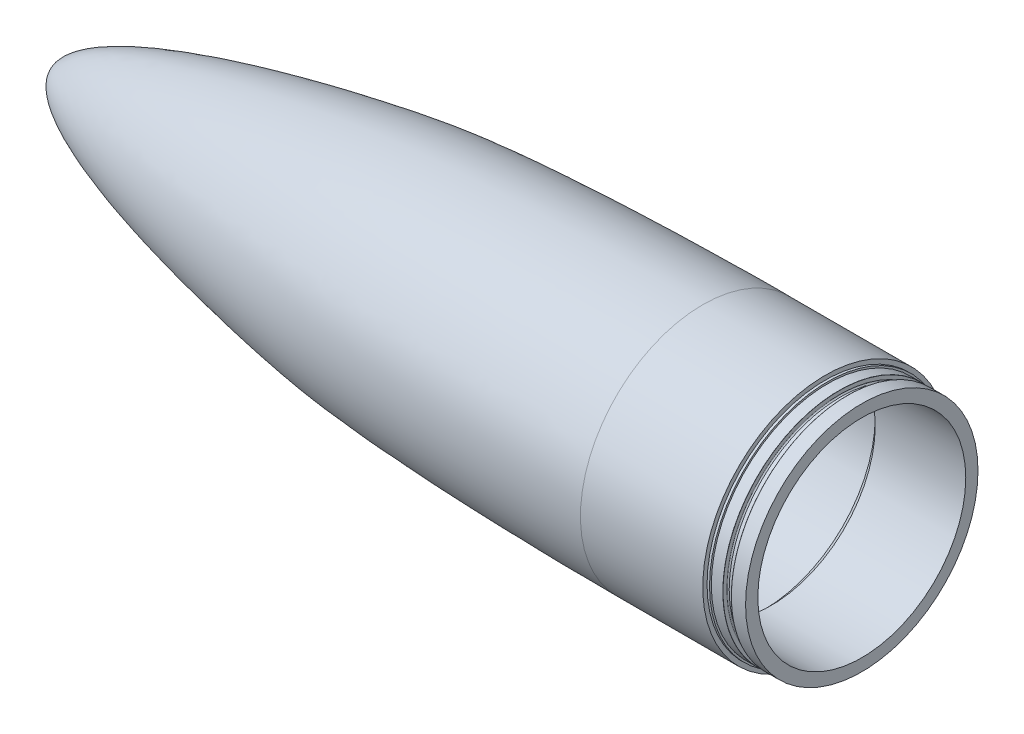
SolidWorks part; units mm, degrees
ref_plane "Plan de face" through (0, 0, 0) normal (0, 0, 1) x (1, 0, 0)
ref_plane "Plan de dessus" through (0, 0, 0) normal (0, 1, 0) x (1, 0, 0)
ref_plane "Plan de droite" through (0, 0, 0) normal (1, 0, 0) x (0, 0, -1)
sketch "Esquisse1" plane through (0, 0, 0) normal (0, 0, 1) x (1, 0, 0)
  line L0 (20.145, 0) -> (-649.6872, 0) construction
  line L1 (0, 100) -> (-100, 100)
  line L2 (-630, 164.8168) -> (-630, -103.939) construction
  line L3 (-630, -39.6237) -> (-630, 40.1591) construction
  line L4 (0, 100) -> (0, 96.5)
  line L5 (-177.0069, 90.9931) -> (-50, 90.9931)
  line L6 (30, 85) -> (-44.0069, 85)
  line L7 (-50, 90.9931) -> (-44.0069, 85)
  line L8 (-177.0069, 90.9931) -> (-178.9877, 89.0123)
  line L9 (-280.1705, 89.0123) -> (-178.9877, 89.0123)
  line L10 (-623.6, 0) -> (-630, 0)
  line L11 (2, 95) -> (11.4, 95)
  line L12 (30, 95) -> (30, 85)
  line L13 (-594.1591, 25) -> (-485.5299, 25) construction
  line L14 (-594.1591, 41.1256) -> (-594.1591, -5.3369) construction
  line L15 (18.4, 95) -> (30, 95)
  line L16 (-166.6522, 112.9695) -> (-166.6522, 62.6617) construction
  line L17 (11.5, 94.9) -> (11.5, 91.9)
  line L18 (0, 96.5) -> (2, 96.5)
  line L19 (2, 95) -> (2, 96.5)
  line L20 (12.5, 90.9) -> (17.3, 90.9)
  line L21 (18.3, 94.9) -> (18.3, 91.9)
  arc A0 (11.5, 91.9) -> (12.5, 90.9) centre (12.5, 91.9) ccw
  arc A1 (17.3, 90.9) -> (18.3, 91.9) centre (17.3, 91.9) ccw
  arc A2 (18.4, 95) -> (18.3, 94.9) centre (18.4, 94.9) ccw
  arc A3 (11.4, 95) -> (11.5, 94.9) centre (11.4, 94.9) cw
  spline S0 degree 3 poles (-100, 100) (-162.1333, 100) (-304.5349, 97.4226) (-476.6711, 71.3103) (-630, 34.0848) (-630, 0) knots 0 0 0 0 0.341762 0.441762 1 1 1 1
  spline S1 degree 1 poles (-100, 93.6) (-623.6, 0) knots 0 0 1 1 construction
  spline S2 degree 3 poles (-100, 93.6) (-100.7148, 93.6) (-102.1356, 93.5995) (-105.0488, 93.5963) (-108.773, 93.5883) (-113.3835, 93.572) (-119.7054, 93.541) (-127.9221, 93.4841) (-138.2335, 93.3852) (-148.9459, 93.2536) (-163.6963, 93.0319) (-182.884, 92.6635) (-206.705, 92.06) (-230.9173, 91.2796) (-255.1163, 90.3072) (-278.897, 89.1277) (-301.851, 87.7263) (-323.5755, 86.0883) (-343.6345, 84.2012) (-361.6947, 82.0508) (-378.6404, 79.6321) (-400.7886, 76.0403) (-429.8144, 70.862) (-465.5759, 63.6676) (-500.8792, 55.5929) (-534.3754, 46.7482) (-564.6874, 37.2524) (-586.1227, 28.9141) (-600.2287, 22.1067) (-609.0825, 16.9895) (-615.9958, 11.9562) (-619.9526, 7.989) (-621.9861, 5.1294) (-622.9751, 3.2005) (-623.4966, 1.4973) (-623.6, 0.5148) (-623.6, 0) knots 0 0 0 0 0.003906 0.007812 0.015625 0.023438 0.03125 0.046875 0.0625 0.078125 0.09375 0.125 0.15625 0.1875 0.21875 0.25 0.28125 0.3125 0.34375 0.375 0.40625 0.4375 0.5 0.5625 0.625 0.6875 0.75 0.8125 0.84375 0.875 0.90625 0.9375 0.953125 0.96875 0.984375 1 1 1 1 only from (-280.1705, 89.0123) to (-623.6, 0)
  dimension "D5" = 100
  dimension "D21" = 1
  dimension "D22" = 0.1
  dimension "D2" = 100
  dimension "D3" = 630
  dimension "D4" = 265
  dimension "D6" = 88
  dimension "D7" = 6.4
  dimension "D9" = 25
  dimension "D10" = 580
  dimension "D11" = 45
  dimension "D12" = 90
  dimension "D13" = 85
  dimension "D14" = 30
  dimension "D15" = 95
  dimension "D16" = 1.5
  dimension "D17" = 2
  dimension "D18" = 4.1
  dimension "D19" = 6.8
  dimension "D20" = 11.5
revolve "Révolution1" add sketch "Esquisse1" angle 360 about L0
sketch "Esquisse2" plane through (0, 0, 0) normal (0, 0, 1) x (1, 0, 0)
  line L0 (-630, 170.8965) -> (-630, -102.2628) construction
